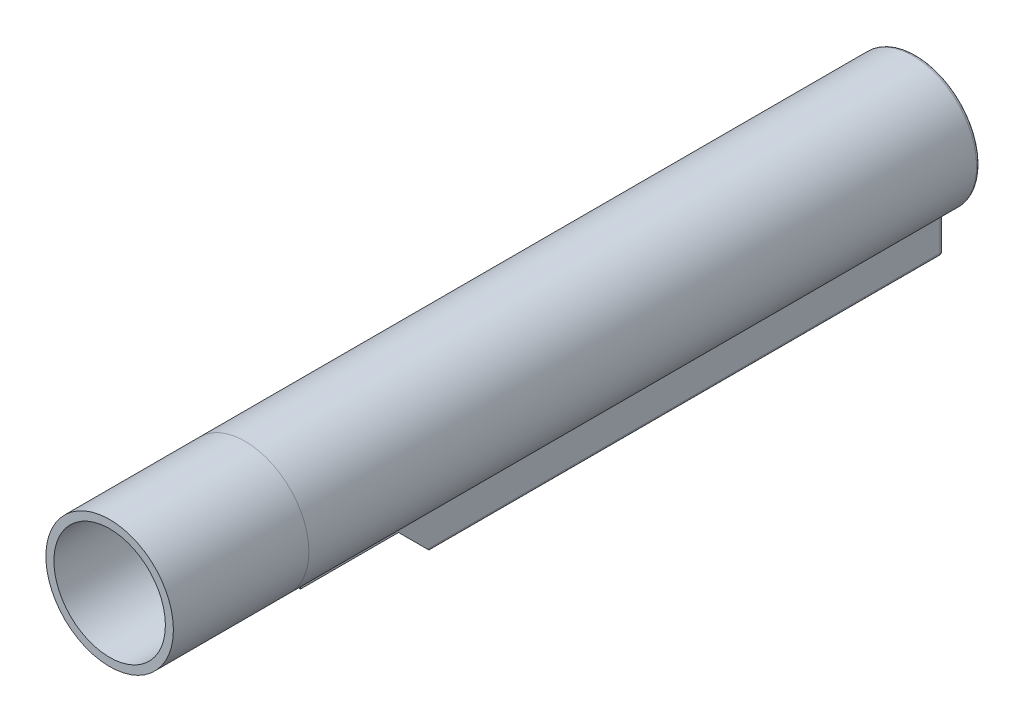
SolidWorks part; units mm, degrees
ref_plane "front" through (0, 0, 0) normal (0, 0, 1) x (1, 0, 0)
ref_plane "top" through (0, 0, 0) normal (0, 1, 0) x (1, 0, 0)
ref_plane "side" through (0, 0, 0) normal (1, 0, 0) x (0, 0, -1)
sketch "Sketch1" plane through (0, 0, 0) normal (0, 0, 1) x (1, 0, 0)
  line L0 (-6.2357, -22.098) -> (6.2357, -22.098)
  line L1 (0, 0) -> (0, -24.4408) construction
  line L2 (0, -50) -> (0, 50) construction
  line L3 (-6.2357, -13.1226) -> (-6.2357, -22.098)
  line L4 (6.2357, -13.1226) -> (6.2357, -22.098)
  line L5 (6.2357, 0) -> (6.2357, -24.4408) construction
  line L6 (-6.2357, 0) -> (-6.2357, -24.4408) construction
  arc A0 (6.2357, -13.1226) -> (-6.2357, -13.1226) centre (0, 0) ccw
  circle A1 centre (0, 0) radius 1.1938
  dimension "D1" = 29.0576
  dimension "D2" = 36.6268
  dimension "D5" = 2.3876
  dimension "D3" = 6.2357
  dimension "D4" = 6.2357
extrude "Boss-Extrude1" add sketch "Sketch1" along normal blind 146.5326
sketch "Sketch2" plane through (0, 0, 146.5326) normal (0, 0, 1) x (1, 0, 0)
  circle A0 centre (0, 0) radius 1.1938 construction
  circle A1 centre (0, 0) radius 1.1938
  circle A2 centre (0, 0) radius 14.5288
extrude "Boss-Extrude2" add sketch "Sketch2" along normal blind 37.2618
sketch "Sketch3" plane through (0, 0, 183.7944) normal (0, 0, 1) x (1, 0, 0)
  line L0 (0, 12.7) -> (0, 14.5288) construction
  circle A1 centre (0, 0) radius 12.7
  circle A2 centre (0, 0) radius 14.5288 construction
  dimension "D1" = 25.4
extrude "Cut-Extrude1" cut sketch "Sketch3" against normal offset from surface (181.9656 mm away) 1.8288
sketch "Sketch4" plane through (0, 0, 146.5326) normal (0, 0, 1) x (1, 0, 0)
  line L1 (10.6396, -33.4161) -> (-19.6356, -33.4161)
  line L2 (10.6396, -33.4161) -> (10.6396, -14.732)
  line L3 (10.6396, -14.732) -> (-19.6356, -14.732)
  line L4 (-19.6356, -33.4161) -> (-19.6356, -14.732)
  circle A0 centre (0, 0) radius 14.5288 construction
  dimension "D1" = 29.2608
extrude "Cut-Extrude2" cut sketch "Sketch4" against normal blind 22.3266
chamfer "Chamfer1" distance 7.366 angle 45 1 edges at (0, -22.098, 124.206)
sketch "Sketch5" plane through (0, -22.098, 0) normal (0, -1, 0) x (1, 0, 0)
  line L0 (0, 97.1677) -> (0, 15.1003) construction
  line L1 (0, -50) -> (0, 50) construction
  line L2 (4.2291, 97.1677) -> (4.2291, 15.1003)
  line L3 (-4.2291, 97.1677) -> (-4.2291, 15.1003)
  line L7 (50, 0) -> (-50, 0) construction
  arc A0 (4.2291, 97.1677) -> (-4.2291, 97.1677) centre (0, 97.1677) ccw
  arc A1 (-4.2291, 15.1003) -> (4.2291, 15.1003) centre (0, 15.1003) ccw
  point P5 (0, 56.134)
  point P10 (0, 10.8712)
  dimension "D2" = 90.5256
  dimension "D1" = 8.4582
  dimension "D3" = 10.8712
extrude "Cut-Extrude3" cut sketch "Sketch5" against normal blind 3.81
sketch "Sketch6" plane through (0, -22.098, 0) normal (0, -1, 0) x (1, 0, 0)
  line L0 (0, -50) -> (0, 50) construction
  circle A0 centre (0, 97.1677) radius 4.2291
  circle A1 centre (0, 15.1003) radius 4.2291
  circle A2 centre (0, 36.1823) radius 4.2291
  circle A3 centre (0, 57.2643) radius 4.2291
  dimension "D1" = 21.082
  dimension "D2" = 21.082
extrude "Cut-Extrude4" cut sketch "Sketch6" against normal blind 7.6962
fillet "Fillet1" radius 0.7874 12 edges at (6.2357, -17.6103, 0) (-6.2357, -17.6103, 0) (0, -22.098, 10.8712) (-4.2291, -22.098, 56.134) (0, -22.098, 101.3968) (-6.2357, -22.098, 58.42) (6.2357, -22.098, 58.42) (0, -22.098, 0) (0, 14.5288, 0) (4.2291, -22.098, 56.134) (6.2357, -13.1226, 73.2663) (-6.2357, -13.1226, 73.2663)
sketch "Sketch7" plane through (0, -22.098, 0) normal (0, -1, 0) x (1, 0, 0)
  line L0 (-40.7896, 152.9334) -> (33.4548, 152.9334)
  line L1 (12.7, 183.7944) -> (-12.7, 183.7944) construction
  point P2 (33.4548, 157.9886)
  dimension "D1" = 30.861
